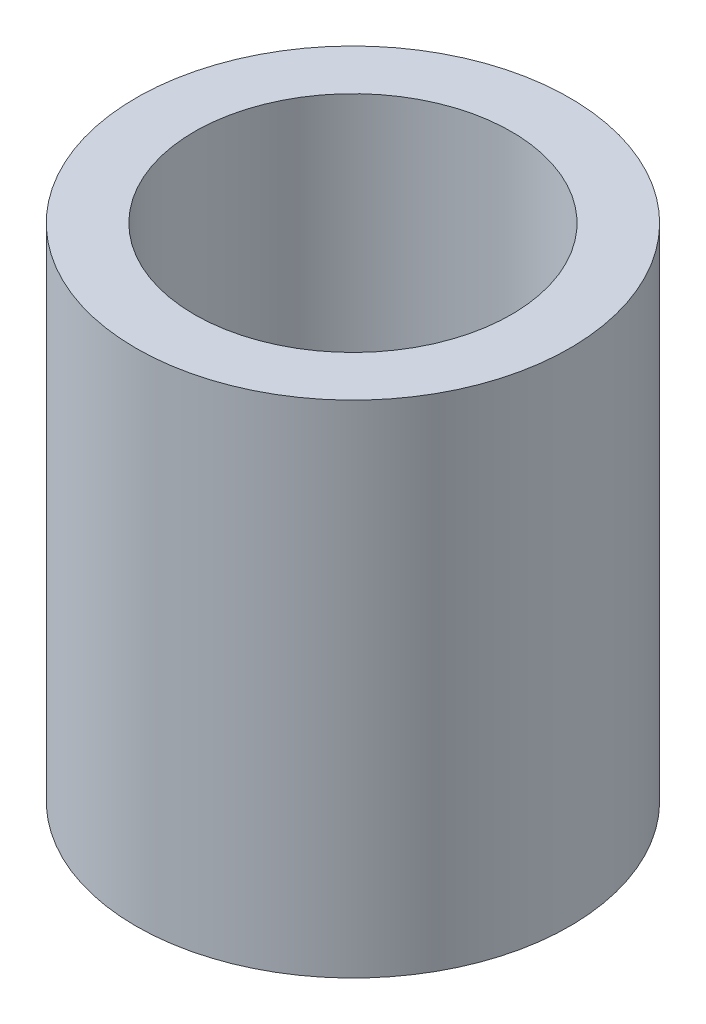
SolidWorks part; units mm, degrees
ref_plane "Plan de face" through (0, 0, 0) normal (0, 0, 1) x (1, 0, 0)
ref_plane "Plan de dessus" through (0, 0, 0) normal (0, 1, 0) x (1, 0, 0)
ref_plane "Plan de droite" through (0, 0, 0) normal (1, 0, 0) x (0, 0, -1)
sketch "Esquisse1" plane through (0, 0, 0) normal (0, 1, 0) x (1, 0, 0)
  circle A0 centre (0, 0) radius 9.5
  circle A1 centre (0, 0) radius 13
  dimension "D1" = 19
  dimension "D2" = 26
extrude "Extrusion1" add sketch "Esquisse1" along normal blind 30
